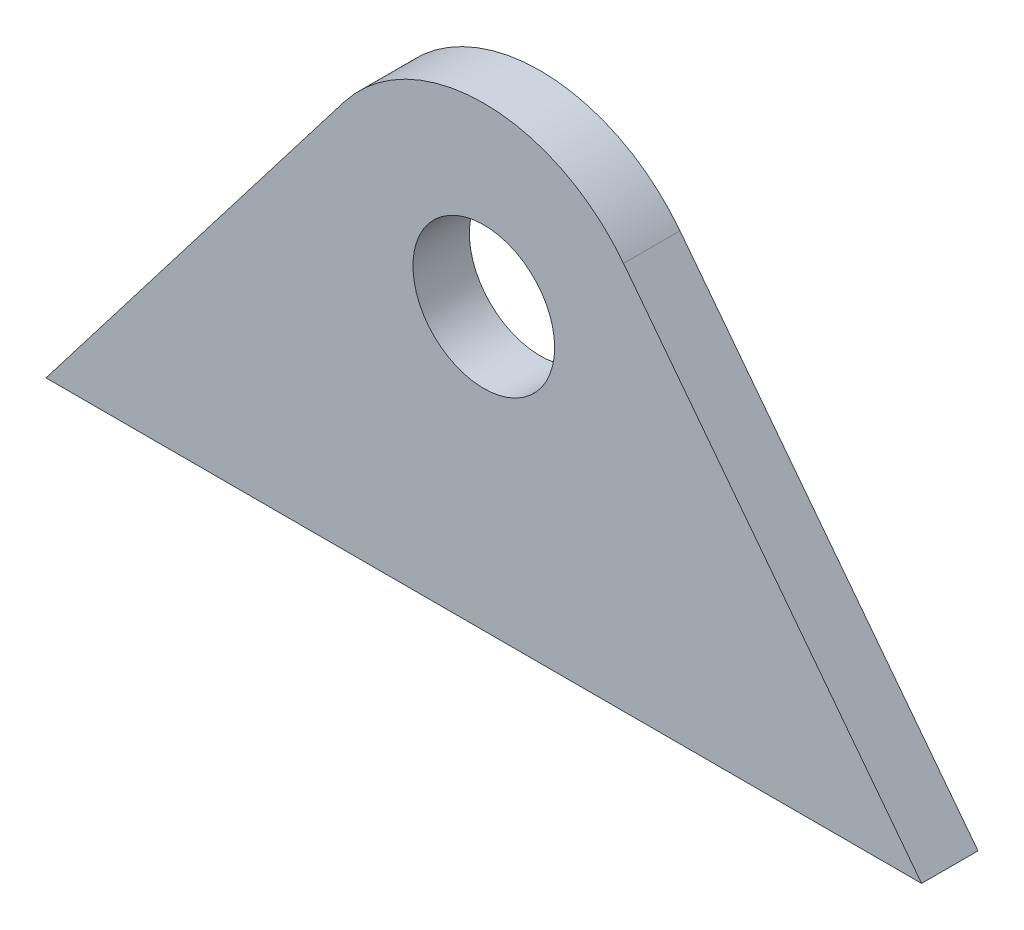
SolidWorks part; units mm, degrees
ref_plane "Plan de face" through (0, 0, 0) normal (0, 0, 1) x (1, 0, 0)
ref_plane "Plan de dessus" through (0, 0, 0) normal (0, 1, 0) x (1, 0, 0)
ref_plane "Plan de droite" through (0, 0, 0) normal (1, 0, 0) x (0, 0, -1)
sketch "Esquisse1" plane through (0, 0, 0) normal (0, 0, 1) x (1, 0, 0)
  line L0 (-62.1, -39.8) -> (62.1, -39.8)
  line L1 (62.1, -39.8) -> (19.8254, 15.23)
  line L2 (-19.8254, 15.23) -> (-62.1, -39.8)
  line L3 (0, 0) -> (0, -39.8) construction
  circle A0 centre (0, 0) radius 10.05
  arc A1 (19.8254, 15.23) -> (-19.8254, 15.23) centre (0, 0) ccw
  dimension "D2" = 20.1
  dimension "D3" = 25
  dimension "D1" = 39.8
  dimension "D4" = 124.2
extrude "Extrusion1" add sketch "Esquisse1" along normal blind 8
